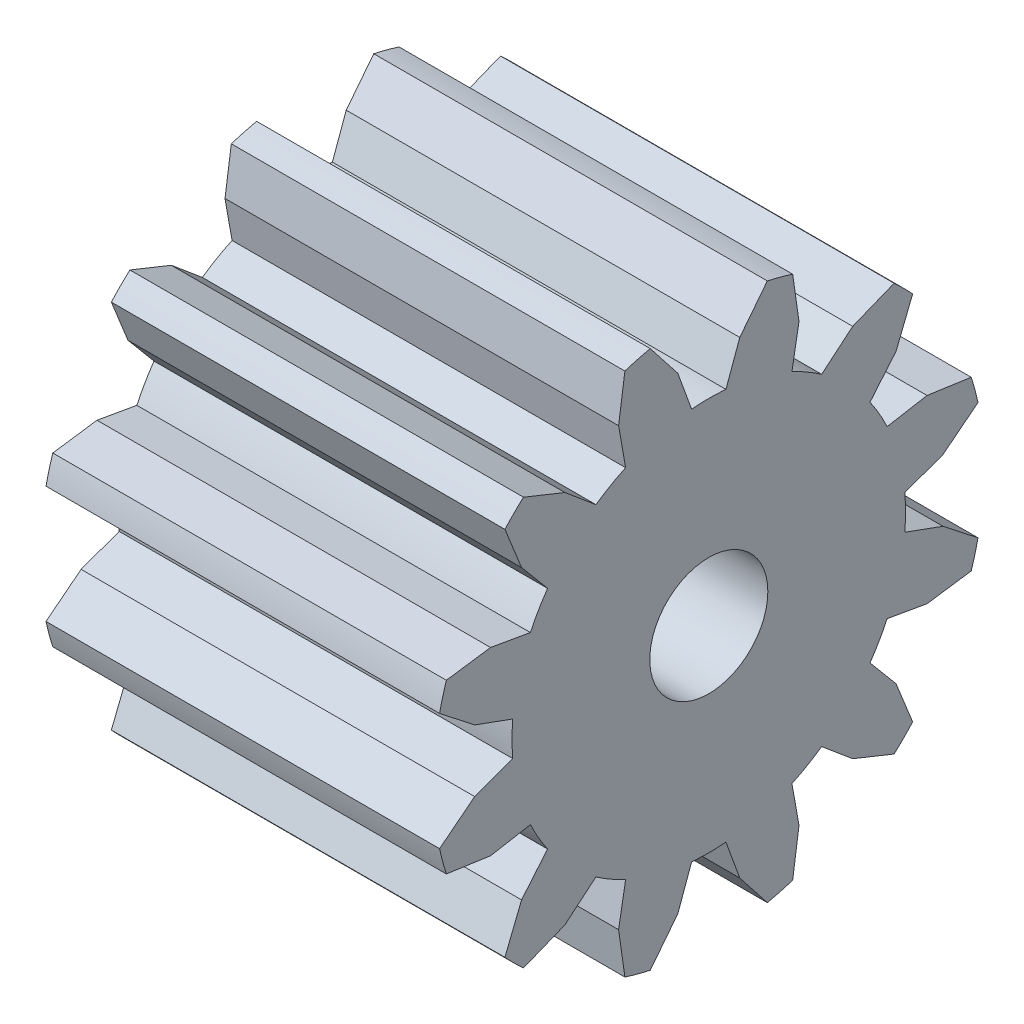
SolidWorks part; units mm, degrees
ref_plane "Front" through (0, 0, 0) normal (0, 0, 1) x (1, 0, 0)
ref_plane "Top" through (0, 0, 0) normal (0, 1, 0) x (1, 0, 0)
ref_plane "Right" through (0, 0, 0) normal (1, 0, 0) x (0, 0, -1)
imported_body "michaud_chailly_A1-40-12-1"
sketch "Esquisse1" plane through (90, 0, 0) normal (1, 0, 0) x (0, 0, -1)
  circle A0 centre (0, 0) radius 15 construction
  circle A1 centre (0, 0) radius 40
  circle A2 centre (0, 0) radius 40
  circle A3 centre (0, 0) radius 15
  dimension "D1" = 0
extrude "Enlèv. mat.-Extru.1" cut sketch "Esquisse1" against normal blind 40
